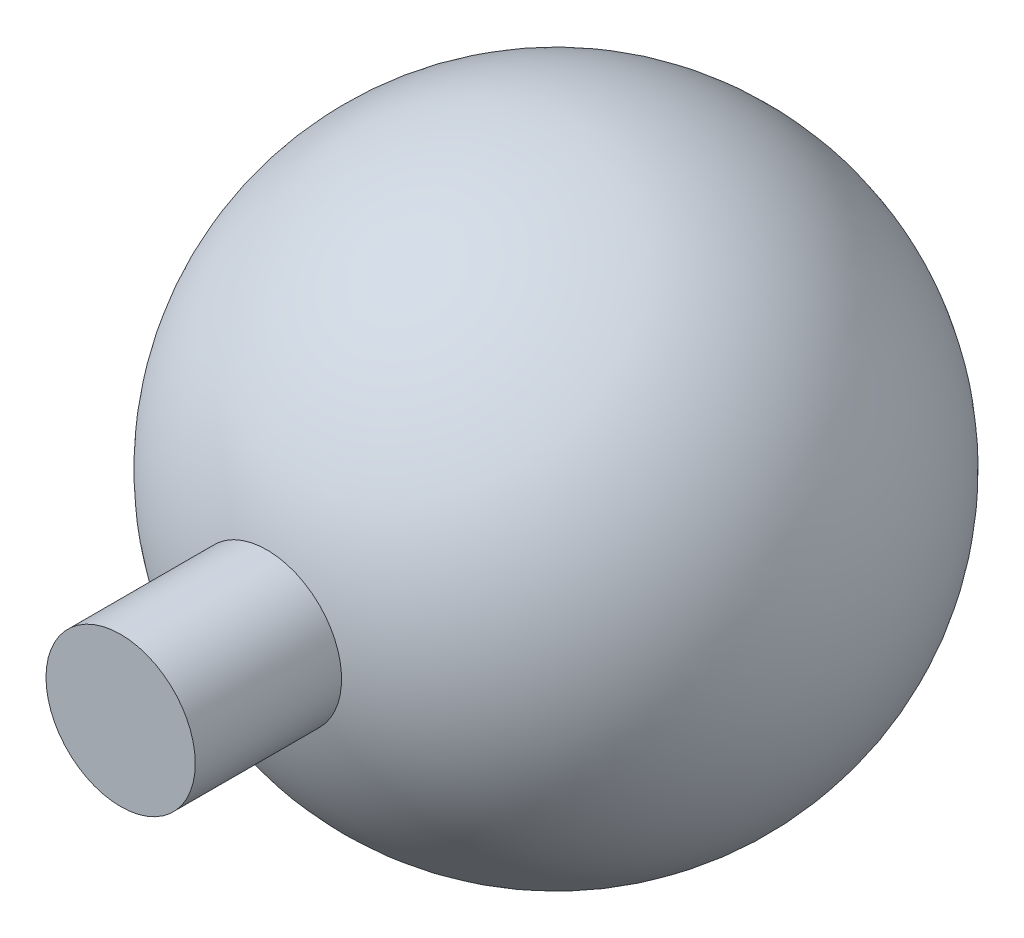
SolidWorks part; units mm, degrees
ref_plane "Plan de face" through (0, 0, 0) normal (0, 0, 1) x (1, 0, 0)
ref_plane "Plan de dessus" through (0, 0, 0) normal (0, 1, 0) x (1, 0, 0)
ref_plane "Plan de droite" through (0, 0, 0) normal (1, 0, 0) x (0, 0, -1)
sketch "Esquisse1" plane through (0, 0, 0) normal (0, 0, 1) x (1, 0, 0)
  line L0 (0, -69.0481) -> (0, 71.9003) construction
  line L1 (0, 48) -> (0, -48)
  arc A0 (0, -48) -> (0, 48) centre (0, 0) ccw
  dimension "D1" = 96
revolve "Révolution1" add sketch "Esquisse1" angle 360 about L0
sketch "Esquisse2" plane through (0, 0, 0) normal (0, 0, 1) x (1, 0, 0)
  circle A0 centre (0, 0) radius 12
  dimension "D1" = 24
extrude "Extrusion1" add sketch "Esquisse2" along normal blind 70
